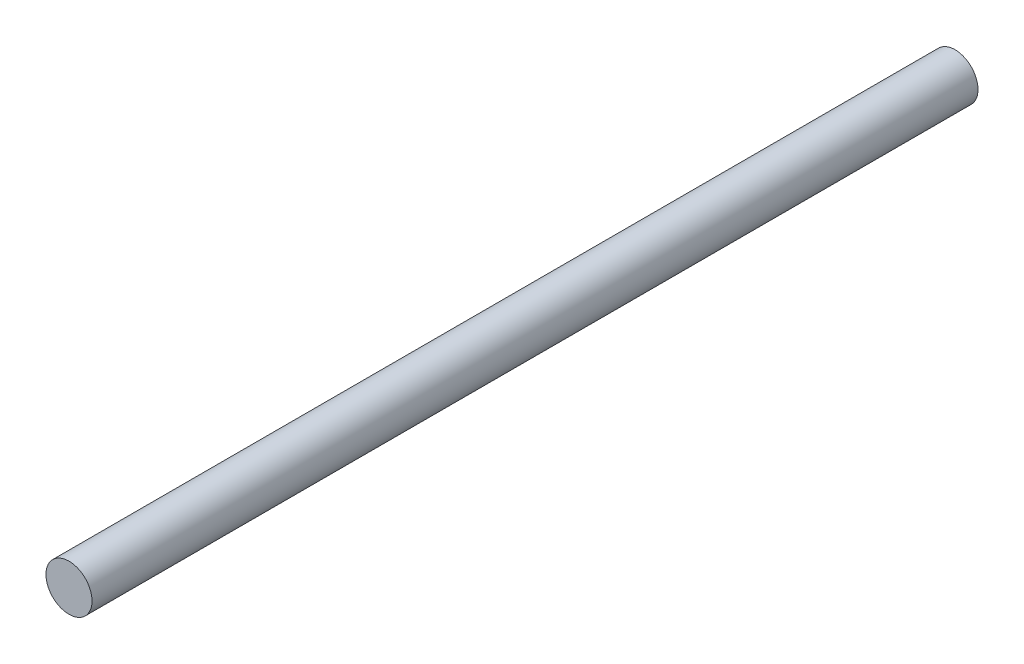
SolidWorks part; units mm, degrees
ref_plane "Plane1" through (0, 0, 0) normal (0, 0, 1) x (1, 0, 0)
ref_plane "Plane2" through (0, 0, 0) normal (0, 1, 0) x (1, 0, 0)
ref_plane "Plane3" through (0, 0, 0) normal (1, 0, 0) x (0, 0, -1)
sketch "Sketch1" plane through (0, 0, 0) normal (0, 0, 1) x (1, 0, 0)
  circle A0 centre (-86.9967, -495.5788) radius 3.25 construction
  circle A1 centre (-86.9967, -495.5788) radius 3.25
extrude "Base-Extrude" add sketch "Sketch1" along normal blind 125
